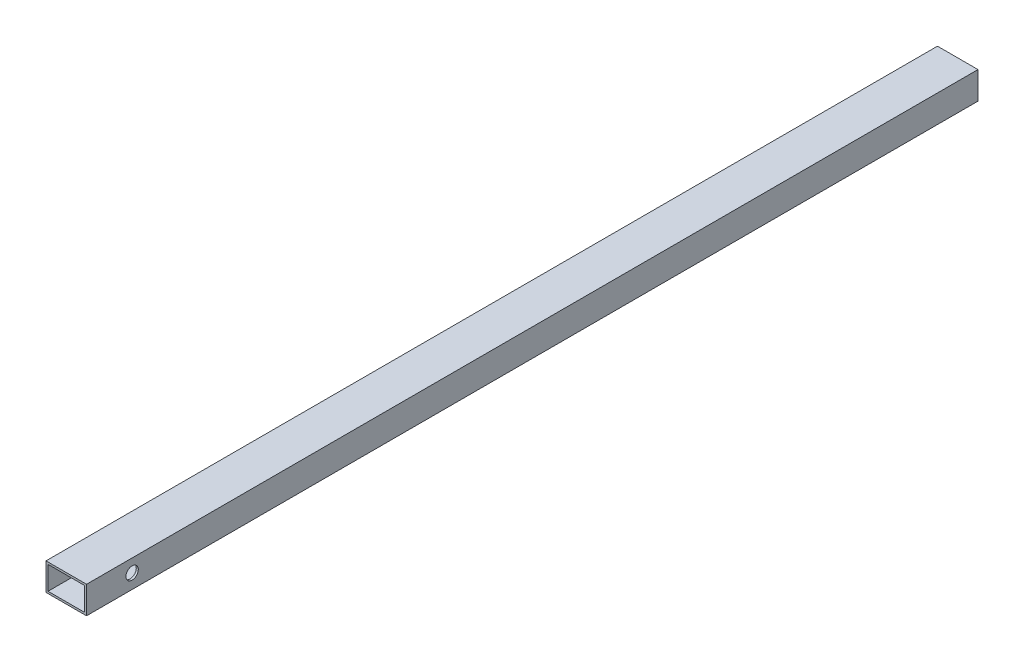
SolidWorks part; units mm, degrees
ref_plane "Plan de face" through (0, 0, 0) normal (0, 0, 1) x (1, 0, 0)
ref_plane "Plan de dessus" through (0, 0, 0) normal (0, 1, 0) x (1, 0, 0)
ref_plane "Plan de droite" through (0, 0, 0) normal (1, 0, 0) x (0, 0, -1)
sketch "Esquisse1" plane through (0, 0, 0) normal (0, 0, 1) x (1, 0, 0)
  line L0 (-2, -2) -> (-2, 25)
  line L1 (0, 0) -> (36, 0)
  line L2 (0, 0) -> (0, 23)
  line L3 (0, 23) -> (36, 23)
  line L4 (36, 0) -> (36, 23)
  line L5 (-2, 25) -> (38, 25)
  line L6 (38, -2) -> (38, 25)
  line L7 (-2, -2) -> (38, -2)
  dimension "D2" = 40
  dimension "D3" = 27
  dimension "D1" = 2
extrude "Extrusion1" add sketch "Esquisse1" along normal blind 880
sketch "Esquisse2" plane through (38, 0, 0) normal (1, 0, 0) x (0, 0, -1)
  circle A0 centre (-835, 12.15) radius 6.1 construction
  circle A2 centre (-835, 12.15) radius 6.1
extrude "Enlèv. mat.-Extru.1" cut sketch "Esquisse2" against normal through all
